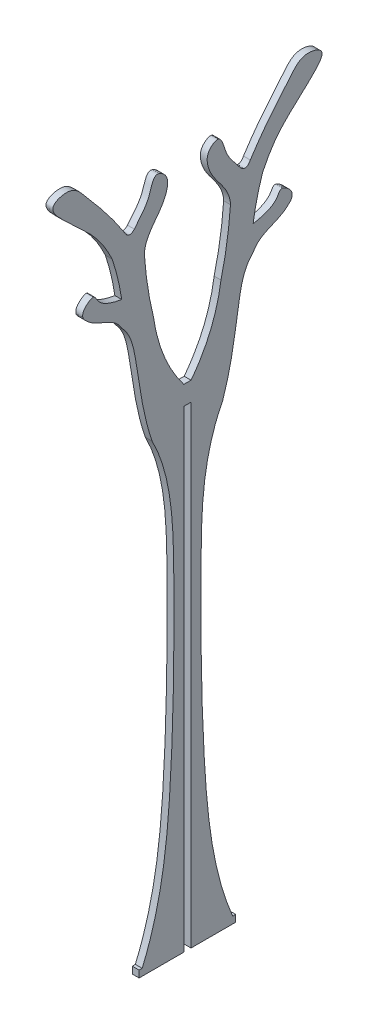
SolidWorks part; units mm, degrees
ref_plane "Piano frontale" through (0, 0, 0) normal (0, 0, 1) x (1, 0, 0)
ref_plane "Piano superiore" through (0, 0, 0) normal (0, 1, 0) x (1, 0, 0)
ref_plane "Piano destro" through (0, 0, 0) normal (1, 0, 0) x (0, 0, -1)
sketch "Schizzo7" plane through (0, 0, 0) normal (1, 0, 0) x (0, 0, -1)
  line L0 (-476.7861, 1122.7802) -> (-457.7861, 1122.7802)
  line L1 (-457.7861, -120.0651) -> (-340.3286, -120.0651)
  line L2 (-457.7861, 1122.7802) -> (-457.7861, -120.0651)
  line L3 (-476.7861, 1122.7802) -> (-476.7861, -120.0651)
  line L4 (-594.2436, -120.0651) -> (-594.2436, -102.0651)
  line L5 (-476.7861, -120.0651) -> (-594.2436, -120.0651)
  line L6 (-457.7861, 1172.7802) -> (-476.7861, 1172.7802)
  line L7 (-594.2436, -102.0651) -> (-586.2446, -102.0651)
  line L8 (-340.3286, -102.0651) -> (-340.3286, -120.0651)
  line L9 (-348.3275, -102.0651) -> (-340.3286, -102.0651)
  spline S0 degree 3 poles (-560.1554, 1085.2903) (-505.8083, 980.4087) (-501.0832, 703.1664) (-503.7311, 362.2145) (-527.8137, 77.3534) (-564.1656, -50.3472) (-586.2446, -102.0651) knots 0 0 0 0 0.287218 0.658216 0.847461 0.984083 0.984083 0.984083 0.984083
  spline S1 degree 3 poles (-560.1554, 1085.2903) (-572.8196, 1122.3901) (-589.5239, 1194.307) (-602.4681, 1296.6727) (-617.3567, 1359.367) (-640.0028, 1382.1958) knots 0 0 0 0 0.37926 0.713288 1 1 1 1
  spline S2 degree 3 poles (-732.6323, 1445.0912) (-705.8252, 1417.1792) (-659.2612, 1418.9959) (-640.0028, 1382.1958) knots 0 0 0 0 1 1 1 1
  spline S3 degree 3 poles (-732.6323, 1445.0912) (-751.6557, 1459.2042) (-738.8099, 1480.5916) (-711.4705, 1493.5199) (-704.0062, 1475.072) (-682.4576, 1456.4606) (-657.1032, 1450.4577) (-640.0028, 1447.5256) knots 0 0 0 0 0.336795 0.409108 0.521188 0.643456 1 1 1 1
  spline S4 degree 2 poles (-640.0028, 1447.5256) (-647.8383, 1500.7932) (-665.0162, 1551.9053) knots 0 0 0 1 1 1
  spline S5 degree 3 poles (-665.0162, 1551.9053) (-702.2218, 1630.1443) (-742.683, 1651.4206) (-840.2655, 1752.3388) (-780.2815, 1769.3588) (-752.8154, 1751.8903) (-728.6649, 1720.8779) (-685.383, 1672.3954) (-651.8711, 1625.9498) (-632.6318, 1596.3007) knots 0 0 0 0 0.385763 0.485334 0.571207 0.624037 0.671733 0.795732 1 1 1 1
  spline S6 degree 2 poles (-476.7861, 1172.7802) (-540.0314, 1255.1269) (-555.5686, 1361.5253) knots 0 0 0 1 1 1
  spline S7 degree 2 poles (-580.4862, 1520.5576) (-574.9396, 1440.0503) (-555.5686, 1361.5253) knots 0 0 0 1 1 1
  spline S8 degree 3 poles (-580.4862, 1520.5576) (-580.0515, 1538.7363) (-564.632, 1570.5842) (-536.4839, 1601.9861) (-523.8697, 1628.3945) (-518.4427, 1648.9633) (-519.1963, 1672.9715) (-554.4566, 1696.4079) (-569.4931, 1632.7406) (-585.1478, 1619.1793) (-606.8268, 1591.2276) knots 0 0 0 0 0.17459 0.335889 0.411381 0.458068 0.543974 0.636309 0.747697 1 1 1 1
  spline S9 degree 2 poles (-632.6318, 1596.3007) (-621.8221, 1576.2379) (-606.8268, 1591.2276) knots 0 0 0 1 1 1
  spline S10 degree 2 poles (-301.9403, 1596.3007) (-312.75, 1576.2379) (-327.7453, 1591.2276) knots 0 0 0 1 1 1
  spline S11 degree 3 poles (-354.086, 1520.5576) (-354.5206, 1538.7363) (-369.9402, 1570.5842) (-398.0883, 1601.9861) (-410.7024, 1628.3945) (-416.1295, 1648.9633) (-415.3758, 1672.9715) (-380.1156, 1696.4079) (-365.079, 1632.7406) (-349.4244, 1619.1793) (-327.7453, 1591.2276) knots 0 0 0 0 0.17459 0.335889 0.411381 0.458068 0.543974 0.636309 0.747697 1 1 1 1
  spline S12 degree 2 poles (-354.086, 1520.5576) (-359.6325, 1440.0503) (-379.0035, 1361.5253) knots 0 0 0 1 1 1
  spline S13 degree 2 poles (-457.7861, 1172.7802) (-394.5408, 1255.1269) (-379.0035, 1361.5253) knots 0 0 0 1 1 1
  spline S14 degree 3 poles (-269.556, 1551.9053) (-232.3503, 1630.1443) (-191.8891, 1651.4206) (-94.3067, 1752.3388) (-154.2907, 1769.3588) (-181.7568, 1751.8903) (-205.9073, 1720.8779) (-249.1892, 1672.3954) (-282.701, 1625.9498) (-301.9403, 1596.3007) knots 0 0 0 0 0.385763 0.485334 0.571207 0.624037 0.671733 0.795732 1 1 1 1
  spline S15 degree 2 poles (-294.5694, 1447.5256) (-286.7338, 1500.7932) (-269.556, 1551.9053) knots 0 0 0 1 1 1
  spline S16 degree 3 poles (-201.9398, 1445.0912) (-182.9165, 1459.2042) (-195.7623, 1480.5916) (-223.1016, 1493.5199) (-230.566, 1475.072) (-252.1146, 1456.4606) (-277.469, 1450.4577) (-294.5694, 1447.5256) knots 0 0 0 0 0.336795 0.409108 0.521188 0.643456 1 1 1 1
  spline S17 degree 3 poles (-201.9398, 1445.0912) (-228.747, 1417.1792) (-275.311, 1418.9959) (-294.5694, 1382.1958) knots 0 0 0 0 1 1 1 1
  spline S18 degree 3 poles (-374.4167, 1085.2903) (-361.7526, 1122.3901) (-345.0482, 1194.307) (-332.104, 1296.6727) (-317.2154, 1359.367) (-294.5694, 1382.1958) knots 0 0 0 0 0.37926 0.713288 1 1 1 1
  spline S19 degree 3 poles (-374.4167, 1085.2903) (-428.7639, 980.4087) (-433.489, 703.1664) (-430.8411, 362.2145) (-406.7584, 77.3534) (-370.4066, -50.3472) (-348.3275, -102.0651) knots 0 0 0 0 0.287218 0.658216 0.847461 0.984083 0.984083 0.984083 0.984083
  point P27 (-639.041, 1596.081)
  point P100 (-467.2861, -120.0651)
  point P101 (-295.5311, 1596.081)
  dimension "D1" = 705.4543
  dimension "D2" = 71.3797
  dimension "D3" = 18
extrude "Estrusione-Estrusione3" add sketch "Schizzo7" along normal blind 18
